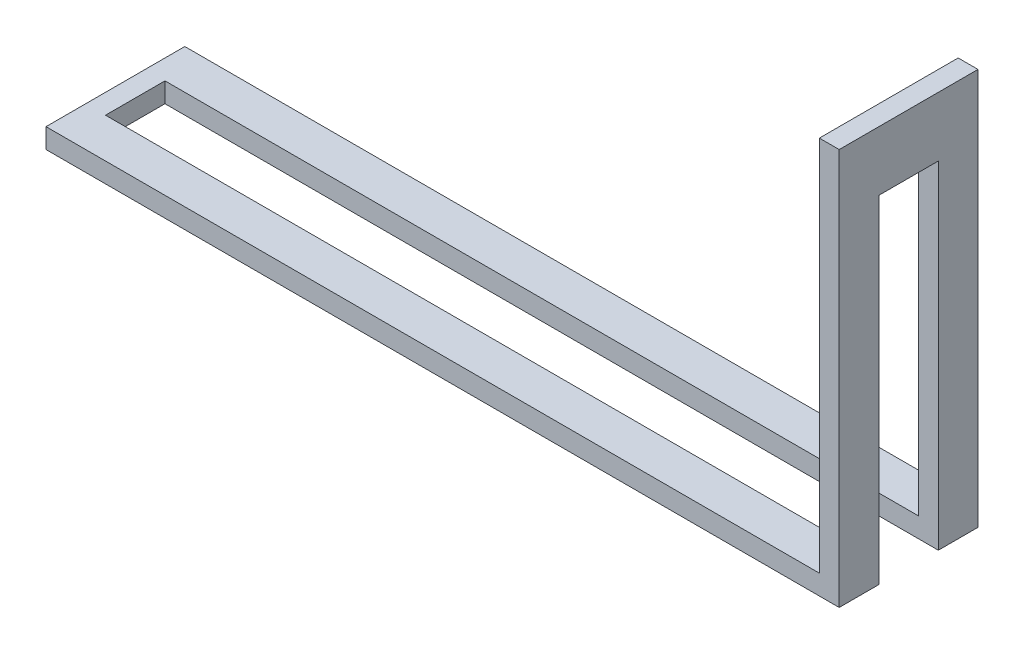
SolidWorks part; units mm, degrees
ref_plane "Plan de face" through (0, 0, 0) normal (0, 0, 1) x (1, 0, 0)
ref_plane "Plan de dessus" through (0, 0, 0) normal (0, 1, 0) x (1, 0, 0)
ref_plane "Plan de droite" through (0, 0, 0) normal (1, 0, 0) x (0, 0, -1)
sketch "Esquisse1" plane through (0, 0, 0) normal (0, 0, 1) x (1, 0, 0)
  line L0 (0, 0) -> (80, 0)
  line L1 (80, 0) -> (80, 40)
  line L2 (80, 40) -> (78, 40)
  line L3 (78, 40) -> (78, 2)
  line L4 (78, 2) -> (0, 2)
  line L5 (0, 2) -> (0, 0)
  dimension "D1" = 80
  dimension "D2" = 2
  dimension "D3" = 2
  dimension "D4" = 40
extrude "Boss.-Extru.1" add sketch "Esquisse1" along normal blind 14
sketch "Esquisse2" plane through (0, 0, 0) normal (0, -1, 0) x (1, 0, 0)
  line L0 (80, 14) -> (80, 0) construction
  line L1 (80, 10) -> (2, 10)
  line L2 (80, 10) -> (80, 4)
  line L3 (80, 4) -> (2, 4)
  line L4 (2, 10) -> (2, 4)
  line L5 (0, 14) -> (80, 14) construction
  dimension "D1" = 6
  dimension "D2" = 4
  dimension "D3" = 78
extrude "Enlèv. mat.-Extru.1" cut sketch "Esquisse2" against normal blind 34
